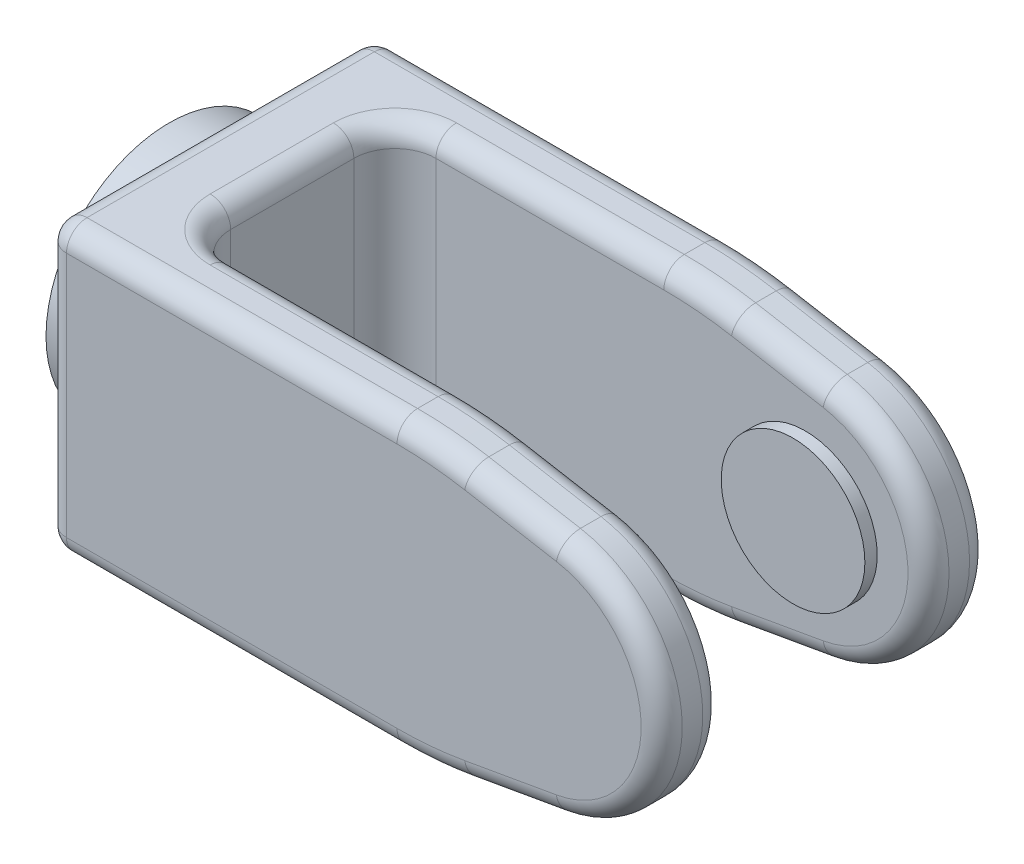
SolidWorks part; units mm, degrees
ref_plane "Front Plane" through (0, 0, 0) normal (0, 0, 1) x (1, 0, 0)
ref_plane "Top Plane" through (0, 0, 0) normal (0, 1, 0) x (1, 0, 0)
ref_plane "Right Plane" through (0, 0, 0) normal (1, 0, 0) x (0, 0, -1)
sketch "Sketch1" plane through (0, 0, 0) normal (0, 0, 1) x (1, 0, 0)
  line L0 (0, 0) -> (94.2683, 0)
  line L1 (94.2683, 0) -> (125.2094, 5.4558)
  line L2 (125.2094, 64.5442) -> (94.2683, 70)
  line L3 (94.2683, 70) -> (0, 70)
  line L4 (0, 70) -> (0, 0)
  arc A0 (125.2094, 5.4558) -> (125.2094, 64.5442) centre (120, 35) ccw
  dimension "D4" = 30
  dimension "D1" = 70
  dimension "D2" = 170
  dimension "D3" = 170
  dimension "D5" = 120
extrude "Boss-Extrude1" add sketch "Sketch1" along normal mid plane 80
sketch "Sketch2" plane through (0, 0, 0) normal (0, 1, 0) x (1, 0, 0)
  line L0 (94.2683, -40) -> (0, -40) construction
  line L1 (20, 25) -> (200, 25)
  line L2 (20, 25) -> (20, -25)
  line L3 (20, -25) -> (200, -25)
  line L4 (200, 25) -> (200, -25)
  line L5 (94.2683, 40) -> (0, 40) construction
  line L6 (0, -40) -> (0, 40) construction
  dimension "D1" = 15
  dimension "D2" = 15
  dimension "D3" = 20
  dimension "D4" = 180
extrude "Cut-Extrude1" cut sketch "Sketch2" along normal through all
sketch "Sketch3" plane through (0, 0, -25) normal (0, 0, 1) x (1, 0, 0)
  circle A0 centre (120, 35) radius 17.5
  dimension "D1" = 35
extrude "Boss-Extrude2" add sketch "Sketch3" along normal blind 3
mirror "Mirror1" about plane through (0, 0, 0) normal (0, 0, 1) of "Boss-Extrude2"
sketch "Sketch4" plane through (0, 0, 0) normal (-1, 0, 0) x (0, 0, 1)
  circle A0 centre (0, 35) radius 30
  dimension "D1" = 60
  dimension "D2" = 35
extrude "Boss-Extrude3" add sketch "Sketch4" along normal blind 10
sketch "Sketch5" plane through (-10, 0, 0) normal (-1, 0, 0) x (0, 0, 1)
  circle A0 centre (0, 35) radius 25
  dimension "D1" = 50
extrude "Boss-Extrude4" add sketch "Sketch5" along normal blind 3
fillet "Fillet1" radius 100 4 edges at (94.2683, 0, -32.5) (94.2683, 0, 32.5) (94.2683, 70, -32.5) (94.2683, 70, 32.5)
fillet "Fillet2" radius 10 2 edges at (20, 35, -25) (20, 35, 25)
fillet "Fillet3" radius 5 38 edges at (94.235, 69.6195, -25) (114.0468, 66.5125, -25) (150, 35, -25) (114.0468, 3.4875, -25) (94.235, 0.3805, -25) (94.235, 0.3805, 25) (114.0468, 3.4875, 25) (150, 35, 25) (114.0468, 66.5125, 25) (94.235, 69.6195, 25) (0, 0, 0) (57.7597, 0, 25) (22.9289, 0, 22.0711) (20, 0, 0) (22.9289, 0, -22.0711) (57.7597, 0, -25) (22.9289, 70, -22.0711) (20, 70, 0) (22.9289, 70, 22.0711) (57.7597, 70, 25) (0, 70, 0) (57.7597, 70, -25) (150, 35, -40) (114.0468, 66.5125, -40) (94.235, 69.6195, -40) (42.7597, 70, -40) (0, 35, -40) (42.7597, 0, -40) (94.235, 0.3805, -40) (114.0468, 3.4875, -40) (0, 35, 40) (42.7597, 70, 40) (94.235, 69.6195, 40) (114.0468, 66.5125, 40) (150, 35, 40) (114.0468, 3.4875, 40) (94.235, 0.3805, 40) (42.7597, 0, 40)
